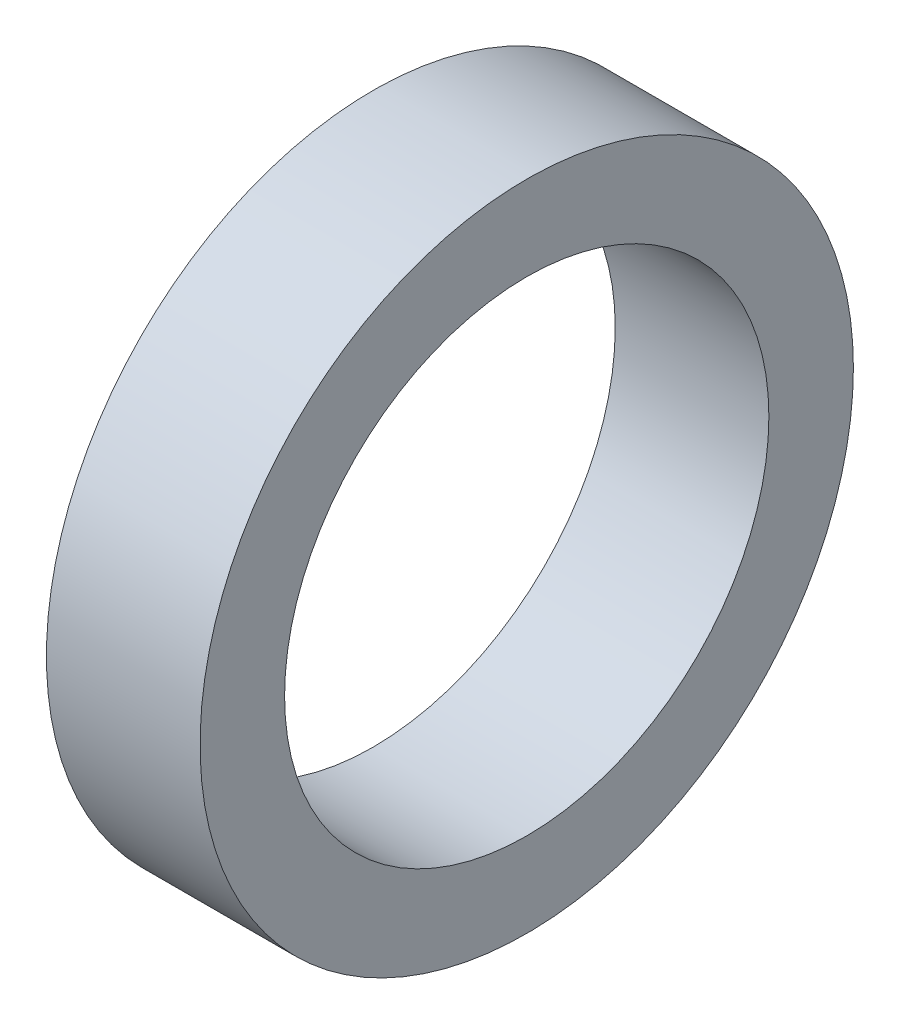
SolidWorks part; units mm, degrees
ref_plane "Front Plane" through (0, 0, 0) normal (0, 0, 1) x (1, 0, 0)
ref_plane "Top Plane" through (0, 0, 0) normal (0, 1, 0) x (1, 0, 0)
ref_plane "Right Plane" through (0, 0, 0) normal (1, 0, 0) x (0, 0, -1)
sketch "Sketch1" plane through (0, 0, 0) normal (1, 0, 0) x (0, 0, -1)
  circle A0 centre (0, 0) radius 13.5001
  circle A1 centre (0, 0) radius 10.0076
extrude "Extrude1" add sketch "Sketch1" along normal blind 6.35
